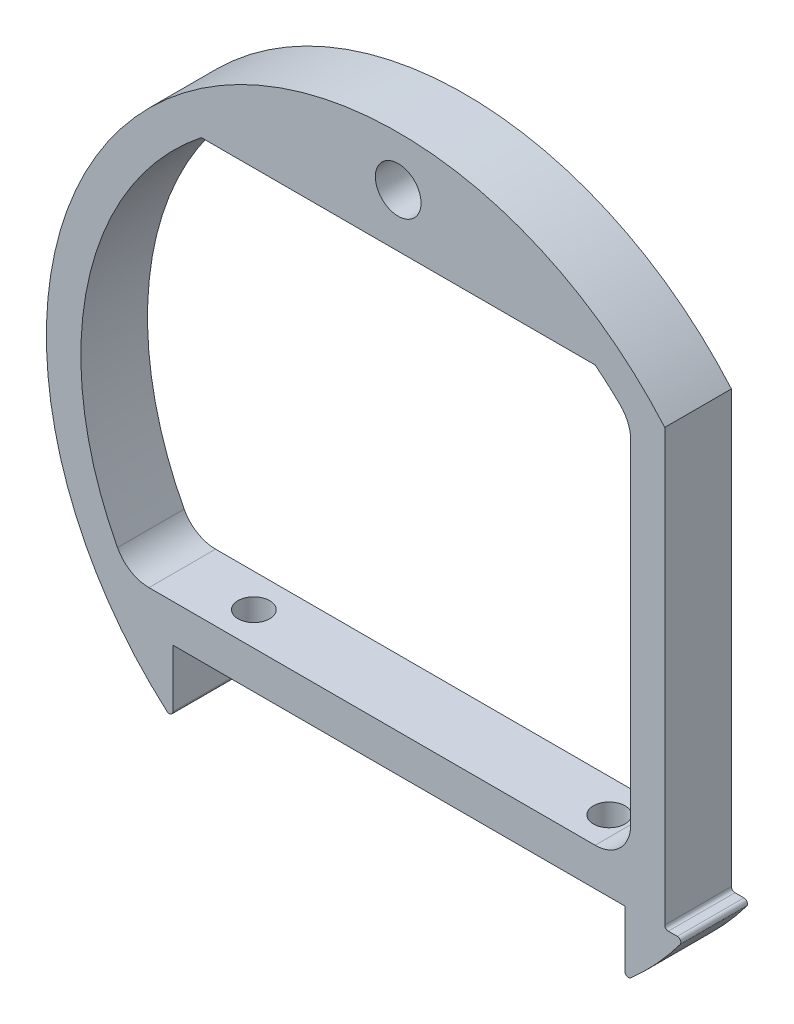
SolidWorks part; units mm, degrees
ref_plane "Front Plane" through (0, 0, 0) normal (0, 0, 1) x (1, 0, 0)
ref_plane "Top Plane" through (0, 0, 0) normal (0, 1, 0) x (1, 0, 0)
ref_plane "Right Plane" through (0, 0, 0) normal (1, 0, 0) x (0, 0, -1)
sketch "Sketch1" plane through (0, 0, 0) normal (0, 0, 1) x (1, 0, 0)
  line L0 (0, 0) -> (-25.146, 0) construction
  line L1 (0, 0) -> (12.573, 21.7771) construction
  line L2 (0, 0) -> (12.573, -21.7771) construction
  circle A0 centre (0, 0) radius 25.146
  dimension "D1" = 50.292
  dimension "D2" = 120
  dimension "D3" = 120
extrude "Boss-Extrude1" add sketch "Sketch1" along normal blind 4.7625
sketch "Sketch2" plane through (0, 0, 4.7625) normal (0, 0, 1) x (1, 0, 0)
  line L1 (-24.9185, -14.6395) -> (24.0391, -14.6395)
  line L2 (-24.9185, -14.6395) -> (-24.9185, -26.8241)
  line L3 (-24.9185, -26.8241) -> (24.0391, -26.8241)
  line L4 (24.0391, -14.6395) -> (24.0391, -26.8241)
extrude "Cut-Extrude1" cut sketch "Sketch2" against normal blind 4.7625
sketch "Sketch3" plane through (0, 0, 4.7625) normal (0, 0, 1) x (1, 0, 0)
  line L1 (29.7951, -26.5733) -> (19.05, -26.5733)
  line L2 (29.7951, -26.5733) -> (29.7951, 23.8125)
  line L3 (29.7951, 23.8125) -> (19.05, 23.8125)
  line L4 (19.05, -26.5733) -> (19.05, 23.8125)
  dimension "D1" = 19.05
extrude "Cut-Extrude3" cut sketch "Sketch3" against normal blind 4.7625
sketch "Sketch5" plane through (0, 0, 4.7625) normal (0, 0, 1) x (1, 0, 0)
  line L0 (16.1942, -14.6395) -> (16.1942, -19.2372)
  line L1 (19.05, -14.6395) -> (-20.4452, -14.6395) construction
  line L2 (19.05, -14.6395) -> (20.4452, -14.6395)
  line L3 (16.1942, -14.6395) -> (19.05, -14.6395)
  line L4 (-16.1067, -14.6395) -> (-16.1067, -19.3105)
  line L5 (-20.4452, -14.6395) -> (-16.1067, -14.6395)
  circle A0 centre (0, 0) radius 25.146 construction
  arc A1 (16.1942, -19.2372) -> (20.4452, -14.6395) centre (0, 0) ccw
  arc A2 (-16.1067, -19.3105) -> (-20.4452, -14.6395) centre (0, 0) cw
extrude "Boss-Extrude2" add sketch "Sketch5" against normal blind 4.7625
fillet "Fillet2" radius 0.254 4 edges at (19.05, -14.6395, 2.3813) (20.4452, -14.6395, 2.3813) (16.1942, -19.2372, 2.3813) (-16.1067, -19.3105, 2.3813)
hole_wizard "#4-40 Tapped Hole1" positions "Sketch6" profile "Sketch7" tap size "#4-40" standard "ANSI Inch"
sketch "Sketch6" plane through (0, -14.6395, 0) normal (0, -1, 0) x (-1, 0, 0)
  line L0 (-16.1942, 0) -> (16.1067, 0) construction
  point P0 (12.7, -2.3813)
  point P2 (-12.7, -2.3813)
  dimension "D1" = 25.4
  dimension "D2" = 12.7
  dimension "D3" = 2.3813
sketch "Sketch7" plane through (-12.7, -14.6395, 2.3813) normal (1, 0, 0) x (0, 0, -1)
  line L0 (0, 0) -> (0, 6.7752)
  line L1 (0, 6.7752) -> (1.1303, 6.096)
  line L2 (1.1303, 6.096) -> (1.1303, 0)
  line L5 (1.1303, 0) -> (0, 0)
  line L10 (0, 6.7752) -> (-1.1303, 6.096) construction
  line L11 (0, -6.35) -> (0, 107.95) construction
  dimension "Tap Drill Dia." = 2.2606
  dimension "Tap Drill Depth" = 6.096
  dimension "Drill Angle" = 118
sketch "Sketch8" plane through (0, 0, 4.7625) normal (0, 0, 1) x (1, 0, 0)
  line L0 (16.6168, 11.9363) -> (16.6168, 15.4391)
  line L3 (-19.2876, -11.9363) -> (16.6168, -11.9363)
  line L4 (16.6168, 11.9363) -> (16.6168, -11.9363)
  circle A0 centre (0, 0) radius 22.6823 construction
  arc A2 (16.6168, 15.4391) -> (-19.2876, -11.9363) centre (0, 0) ccw
  point P0 (0, 0)
extrude "Cut-Extrude4" cut sketch "Sketch8" against normal blind 4.7625
fillet "Fillet3" radius 2.54 3 edges at (16.6168, 15.4391, 2.3813) (16.6168, -11.9363, 2.3813) (-19.2876, -11.9363, 2.3813)
sketch "Sketch9" plane through (0, 0, 4.7625) normal (0, 0, 1) x (1, 0, 0)
  line L0 (-14.0723, 17.7892) -> (14.0723, 17.7892)
  circle A0 centre (0, 0) radius 22.6823 construction
  arc A1 (14.0723, 17.7892) -> (-14.0723, 17.7892) centre (0, 0) ccw
extrude "Boss-Extrude3" add sketch "Sketch9" against normal blind 4.7625 separate body
combine bodies "Combine1" operation type add bodies to combine 106 107
hole_wizard "#4 Clearance Hole1" positions "Sketch10" profile "Sketch11" hole size "#4" standard "ANSI Inch"
sketch "Sketch10" plane through (0, 0, 4.7625) normal (0, 0, 1) x (1, 0, 0)
  point P0 (0, 21.59)
  dimension "D1" = 21.59
sketch "Sketch11" plane through (0, 21.59, 4.7625) normal (1, 0, 0) x (0, -1, 0)
  line L0 (0, 0) -> (0, 26.3806)
  line L1 (0, 26.3806) -> (1.6319, 25.4)
  line L2 (1.6319, 25.4) -> (1.6319, 0)
  line L5 (1.6319, 0) -> (0, 0)
  line L10 (0, 26.3806) -> (-1.632, 25.4) construction
  line L11 (0, -6.35) -> (0, 107.95) construction
  dimension "Hole Dia." = 3.2639
  dimension "Hole Depth" = 25.4
  dimension "Drill Angle" = 118
